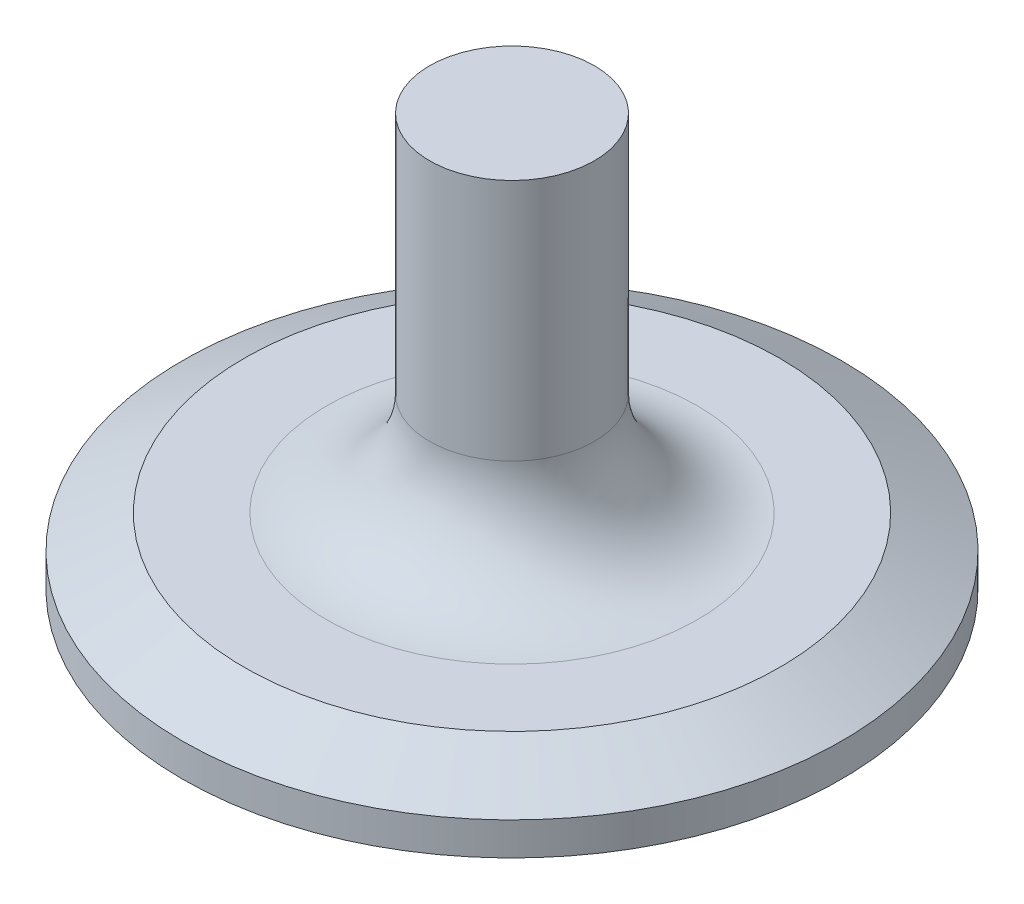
SolidWorks part; units mm, degrees
ref_plane "前视基准面" through (0, 0, 0) normal (0, 0, 1) x (1, 0, 0)
ref_plane "上视基准面" through (0, 0, 0) normal (0, 1, 0) x (1, 0, 0)
ref_plane "右视基准面" through (0, 0, 0) normal (1, 0, 0) x (0, 0, -1)
sketch "Sketch1" plane through (0, 0, 0) normal (0, 0, 1) x (1, 0, 0)
  line L0 (0, -70.2514) -> (0, 103.5707) construction
  line L1 (0, 0) -> (-80, 0)
  line L2 (-80, 0) -> (-80, 8)
  line L3 (-80, 8) -> (-65, 16)
  line L4 (-65, 16) -> (-45, 16)
  line L5 (-20, 41) -> (-20, 100)
  line L6 (-20, 100) -> (0, 100)
  line L7 (0, 100) -> (0, 0)
  arc A0 (-45, 16) -> (-20, 41) centre (-45, 41) ccw
  dimension "D3" = 25
  dimension "D1" = 20
  dimension "D2" = 80
  dimension "D4" = 16
  dimension "D5" = 8
  dimension "D6" = 100
  dimension "D7" = 15
revolve "Revolve1" add sketch "Sketch1" angle 360 about L0
